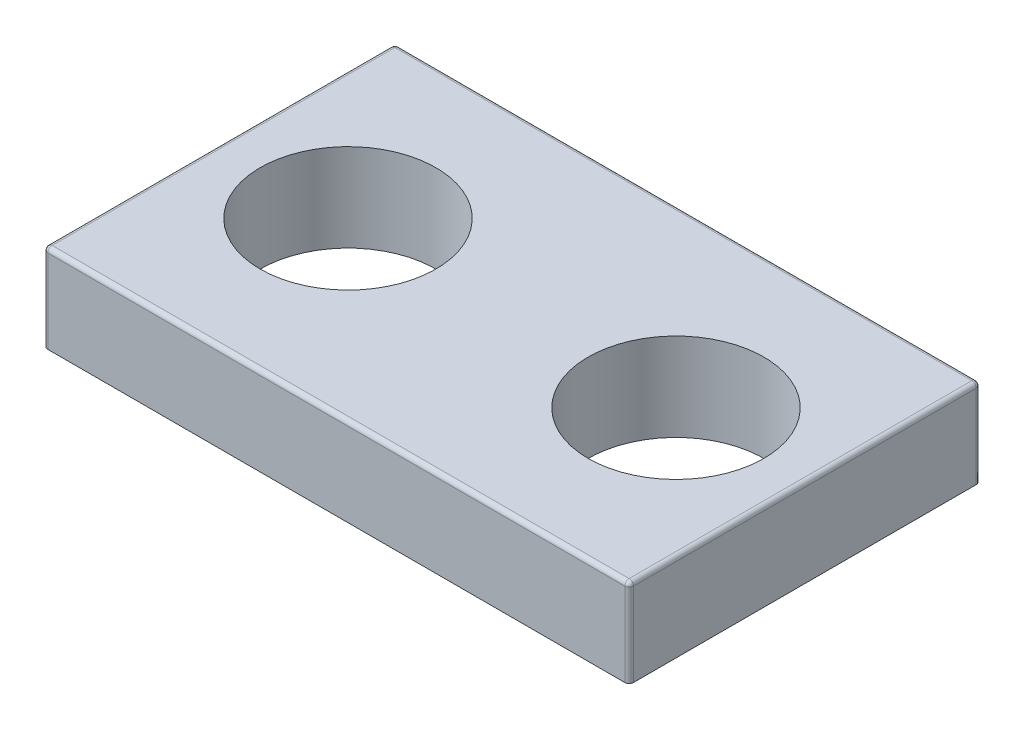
SolidWorks part; units mm, degrees
ref_plane "Front Plane" through (0, 0, 0) normal (0, 0, 1) x (1, 0, 0)
ref_plane "Top Plane" through (0, 0, 0) normal (0, 1, 0) x (1, 0, 0)
ref_plane "Right Plane" through (0, 0, 0) normal (1, 0, 0) x (0, 0, -1)
sketch "Sketch1" plane through (0, 0, 0) normal (0, 1, 0) x (1, 0, 0)
  line L0 (-28, 0) -> (28, 0) construction
  line L1 (-50, -30) -> (50, -30)
  line L2 (-50, -30) -> (-50, 30)
  line L3 (-50, 30) -> (50, 30)
  line L4 (50, -30) -> (50, 30)
  line L5 (-50, -30) -> (50, 30) construction
  line L6 (-50, 30) -> (50, -30) construction
  circle A0 centre (-28, 0) radius 15
  circle A1 centre (28, 0) radius 15
  point P0 (0, 0)
  dimension "D3" = 22
  dimension "D4" = 30
  dimension "D5" = 22
  dimension "D1" = 100
  dimension "D2" = 60
extrude "Boss-Extrude1" add sketch "Sketch1" along normal blind 15
fillet "Fillet1" radius 0.75 8 edges at (-50, 7.5, 30) (-50, 7.5, -30) (50, 7.5, -30) (50, 7.5, 30) (0, 15, 30) (0, 15, -30) (50, 15, 0) (-50, 15, 0)
